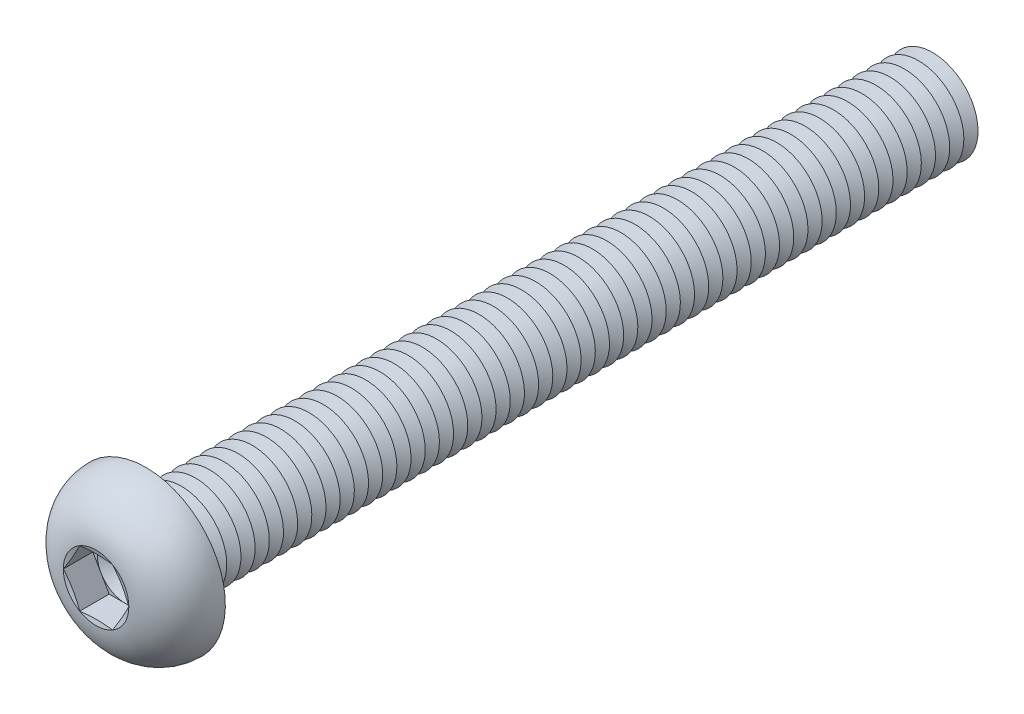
SolidWorks part; units mm, degrees
ref_plane "Front Plane" through (0, 0, 0) normal (0, 0, 1) x (1, 0, 0)
ref_plane "Top Plane" through (0, 0, 0) normal (0, 1, 0) x (1, 0, 0)
ref_plane "Right Plane" through (0, 0, 0) normal (1, 0, 0) x (0, 0, -1)
sketch "Sketch1" plane through (0, 0, 0) normal (1, 0, 0) x (0, 0, -1)
  line L0 (0, 4) -> (0, 7)
  line L3 (0, 4) -> (70, 4)
  line L4 (70, 4) -> (70, 0)
  line L5 (70, 0) -> (-4.4, 0) construction
  line L6 (-4.4, 0) -> (70, 0)
  line L7 (-4.4, 2.8867) -> (-4.4, 1.4434) construction
  line L8 (-4.4, 1.4434) -> (-4.4, 0)
  line L9 (-4.4, 2.8867) -> (-4.0132, 1.4434)
  line L10 (-4.0132, 1.4434) -> (-4.4, 1.4434)
  line L11 (70, 0) -> (22.7481, 0) construction
  line L12 (0, 7) -> (-4.4, 7) construction
  arc A1 (0, 7) -> (-4.4, 2.8867) centre (0, 2.59) ccw
  point P8 (70, 2)
  dimension "D1" = 14
  dimension "D2" = 8
  dimension "D3" = 4.4
  dimension "D4" = 5.7735
  dimension "D5" = 70
  dimension "D6" = 15
revolve "Revolve1" add sketch "Sketch1" angle 360 about L5
fillet "Fillet1" radius 0.625 1 edges at (0, 4, 0)
sketch "Sketch2" plane through (0, 0, 0) normal (1, 0, 0) x (0, 0, -1)
  line L0 (69.375, 4) -> (70.625, 4)
  line L1 (70, 4) -> (0.625, 4) construction
  line L2 (70.625, 4) -> (70, 2.9175)
  line L3 (70, -4) -> (70, 4) construction
  line L4 (70, 2.9175) -> (69.375, 4)
  dimension "D1" = 1.25
revolve "Cut-Revolve1" cut sketch "Sketch2" angle 360 about axis through (0, 0, -70) along (0, 0, -1)
pattern_linear "LPattern1" count 56 spacing 1.25 along (0, 0, 1) of "Cut-Revolve1"
sketch "Sketch3" plane through (0, 0, 4.4) normal (0, 0, 1) x (1, 0, 0)
  line L7 (1.4434, 2.5) -> (-1.4434, 2.5)
  line L8 (-1.4434, 2.5) -> (-2.8867, 0)
  line L9 (-2.8867, 0) -> (-1.4434, -2.5)
  line L10 (-1.4434, -2.5) -> (1.4434, -2.5)
  line L11 (1.4434, -2.5) -> (2.8867, 0)
  line L12 (2.8867, 0) -> (1.4434, 2.5)
  circle A0 centre (0, 0) radius 2.5 construction
  circle A3 centre (0, 0) radius 2.8867 construction
extrude "Cut-Extrude1" cut sketch "Sketch3" against normal blind 2.6
sketch "Sketch4" plane through (0, 0, 1.8) normal (0, 0, 1) x (1, 0, 0)
  line L1 (1.4434, 2.5) -> (-1.4434, 2.5) construction
  circle A0 centre (0, 0) radius 2.5
extrude "Cut-Extrude2" cut sketch "Sketch4" against normal through all draft 60
